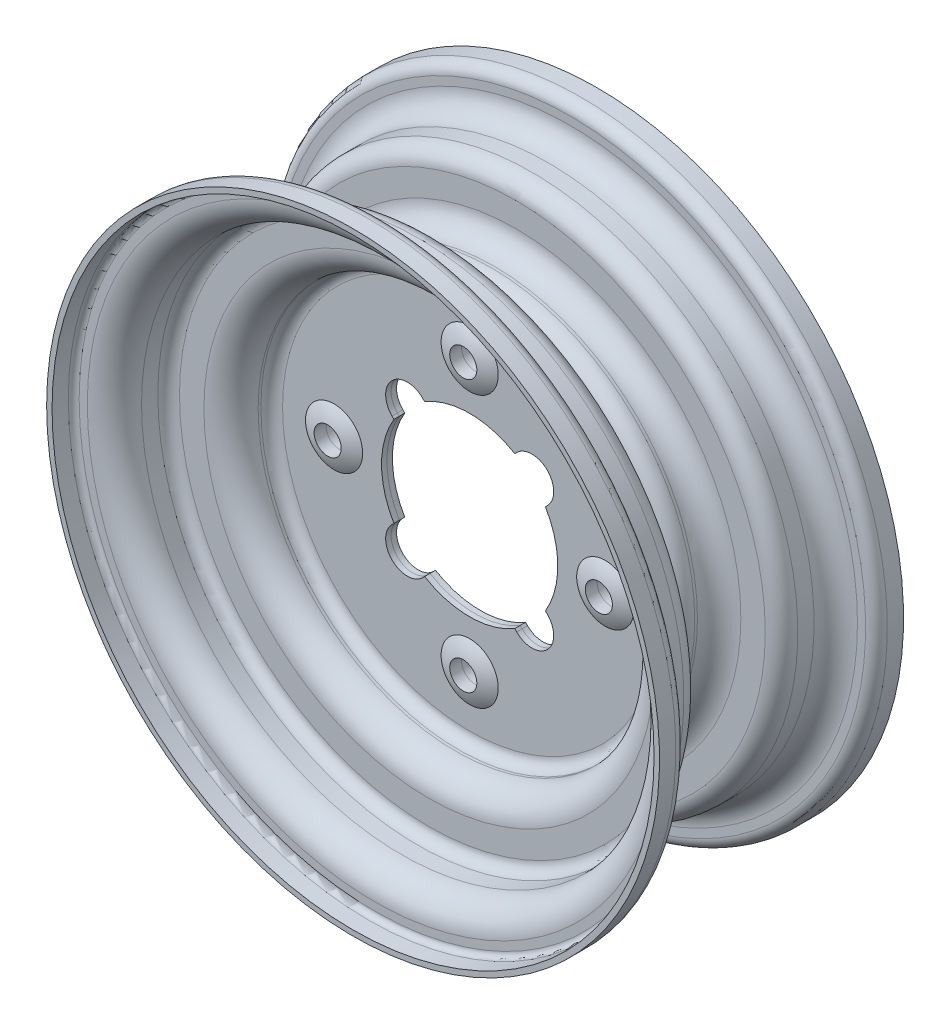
SolidWorks part; units mm, degrees
ref_plane "Front Plane" through (0, 0, 0) normal (0, 0, 1) x (1, 0, 0)
ref_plane "Top Plane" through (0, 0, 0) normal (0, 1, 0) x (1, 0, 0)
ref_plane "Right Plane" through (0, 0, 0) normal (1, 0, 0) x (0, 0, -1)
sketch "Sketch1" plane through (0, 0, 0) normal (1, 0, 0) x (0, 0, -1)
  line L0 (0, 0) -> (0, 69)
  line L1 (-6, 75) -> (-7, 75)
  line L2 (-15, 83) -> (-15, 92)
  line L3 (-21, 98) -> (-27, 98)
  line L4 (-35, 106) -> (-35, 109)
  line L5 (-39, 113) -> (-45, 113)
  line L6 (0, 0) -> (-31.4596, 0) construction
  arc A0 (-7, 75) -> (-15, 83) centre (-7, 83) cw
  arc A1 (-27, 98) -> (-35, 106) centre (-27, 106) cw
  arc A2 (-15, 92) -> (-21, 98) centre (-21, 92) ccw
  arc A3 (0, 69) -> (-6, 75) centre (-6, 69) ccw
  arc A4 (-35, 109) -> (-39, 113) centre (-39, 109) ccw
  point P19 (-35, 113)
  dimension "D7" = 8
  dimension "D8" = 6
  dimension "D9" = 4
  dimension "D1" = 226
  dimension "D2" = 150
  dimension "D3" = 15
  dimension "D4" = 45
  dimension "D5" = 10
  dimension "D6" = 15
revolve "Revolve-Thin1" add sketch "Sketch1" angle 360 about L6
sketch "Sketch2" plane through (0, 0, 2) normal (0, 0, 1) x (1, 0, 0)
  line L0 (22.981, -22.981) -> (-22.981, 22.981) construction
  line L1 (17.3241, -28.6378) -> (-28.6378, 17.3241)
  line L2 (28.6378, -17.3241) -> (-17.3241, 28.6378)
  line L3 (-22.981, -22.981) -> (22.981, 22.981) construction
  line L4 (-28.6378, -17.3241) -> (17.3241, 28.6378)
  line L5 (-17.3241, -28.6378) -> (28.6378, 17.3241)
  arc A0 (17.3241, -28.6378) -> (28.6378, -17.3241) centre (22.981, -22.981) ccw
  arc A1 (-17.3241, 28.6378) -> (-28.6378, 17.3241) centre (-22.981, 22.981) ccw
  arc A2 (-28.6378, -17.3241) -> (-17.3241, -28.6378) centre (-22.981, -22.981) ccw
  arc A3 (28.6378, 17.3241) -> (17.3241, 28.6378) centre (22.981, 22.981) ccw
  circle A4 centre (0, 0) radius 32.5
  point P2 (0, 0)
  point P9 (0, 0)
  dimension "D1" = 65
  dimension "D2" = 8
extrude "Cut-Extrude1" cut sketch "Sketch2" against normal through all contours A4 L2 A1 L1 | A4 L5 A3 L4 | A4 L1 A0 L2 | A4 L4 A2 L5
sketch "Sketch3" plane through (0, 0, 0) normal (0, 1, 0) x (1, 0, 0)
  line L0 (-50, -2) -> (-39.4643, -2)
  line L1 (-69, -2) -> (69, -2) construction
  line L2 (-50, -5) -> (-50, -2)
  arc A0 (-50, -5) -> (-39.4643, -2) centre (-50, 15) ccw
  dimension "D2" = 20
  dimension "D1" = 3
  dimension "D3" = 50
revolve "Revolve1" add sketch "Sketch3" angle 360 about L2
sketch "Sketch4" plane through (0, 0, 2) normal (0, 0, 1) x (1, 0, 0)
  circle A0 centre (-50, 0) radius 5
  dimension "D1" = 10
extrude "Cut-Extrude2" cut sketch "Sketch4" against normal through all and the other way through all
pattern_circular "CirPattern1" count 4 over 360 about axis through (0, 0, 0) along (0, 0, 1) of "Revolve1", "Cut-Extrude2"
mirror "Mirror1" about plane through (0, 0, 0) normal (0, 0, 1)
